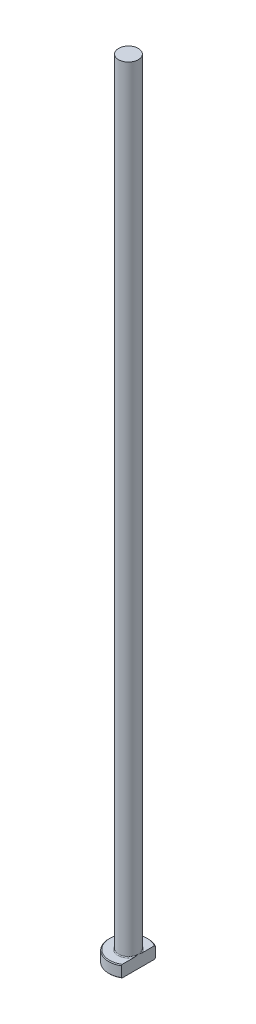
SolidWorks part; units mm, degrees
ref_plane "Front Plane" through (0, 0, 0) normal (0, 0, 1) x (1, 0, 0)
ref_plane "Top Plane" through (0, 0, 0) normal (0, 1, 0) x (1, 0, 0)
ref_plane "Right Plane" through (0, 0, 0) normal (1, 0, 0) x (0, 0, -1)
sketch "Sketch1" plane through (0, 0, 0) normal (0, 0, 1) x (1, 0, 0)
  line L0 (0, 259.9588) -> (0, -15.1925) construction
  line L1 (0, 0) -> (-5, 0)
  line L2 (-5, 0) -> (-5, 3)
  line L3 (-5, 3) -> (-2.5, 3)
  line L4 (-2.5, 3) -> (-2.5, 200)
  line L5 (-2.5, 200) -> (0, 200)
  line L6 (0, 200) -> (0, 0)
  dimension "L" = 200
  dimension "H" = 10
  dimension "T" = 3
  dimension "D" = 5
revolve "Revolve1" add sketch "Sketch1" angle 360 about L0
chamfer "Chamfer1" distance 0.2 angle 45 2 edges at (0, 3, 5) (0, 0, 5)
fillet "Fillet1" radius 0.2 1 edges at (0, 3, 2.5)
sketch "Sketch2" plane through (0, 0, 0) normal (0, 1, 0) x (1, 0, 0)
  line L0 (2.5, 4.3301) -> (2.5, -4.3301)
  circle A0 centre (0, 0) radius 5 construction
  arc A1 (2.5, -4.3301) -> (2.5, 4.3301) centre (0, 0) ccw
  circle A2 centre (0, 0) radius 2.5 construction
extrude "KEY" cut sketch "Sketch2" along normal through all
